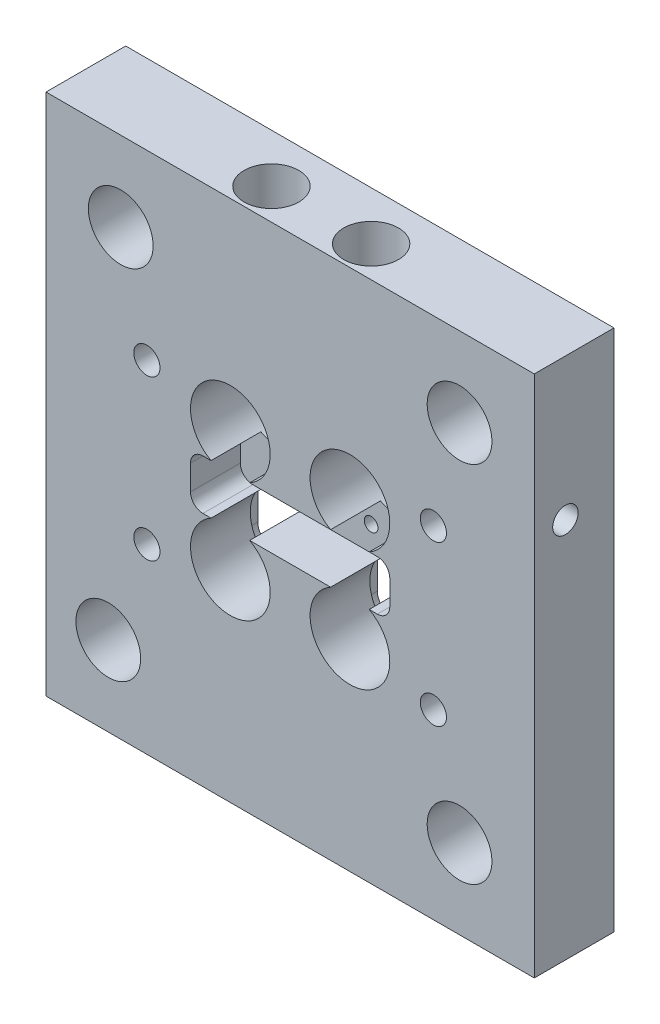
SolidWorks part; units mm, degrees
ref_plane "Plan de face" through (0, 0, 0) normal (0, 0, 1) x (1, 0, 0)
ref_plane "Plan de dessus" through (0, 0, 0) normal (0, 1, 0) x (1, 0, 0)
ref_plane "Plan de droite" through (0, 0, 0) normal (1, 0, 0) x (0, 0, -1)
sketch "Esquisse1" plane through (0, 0, 0) normal (0, 0, 1) x (1, 0, 0)
  line L1 (0, 0) -> (196, 0)
  line L2 (0, 0) -> (0, 210)
  line L3 (0, 210) -> (196, 210)
  line L4 (196, 0) -> (196, 210)
  dimension "D1" = 210
  dimension "D2" = 196
extrude "Extrusion1" add sketch "Esquisse1" along normal blind 32
sketch "Esquisse3" plane through (0, 0, 0) normal (0, 0, -1) x (-1, 0, 0)
  line L0 (-98, 210) -> (-98, 0) construction
  line L1 (-196, 210) -> (0, 210) construction
  line L2 (0, 0) -> (-196, 0) construction
  line L3 (-196, 105) -> (0, 105) construction
  line L4 (-196, 0) -> (-196, 210) construction
  line L5 (0, 210) -> (0, 0) construction
  line L6 (-214.75, 178) -> (45.0645, 178) construction
  line L7 (-218.7232, 32) -> (22.112, 32) construction
  line L8 (-166, 220.8332) -> (-166, -13.5838) construction
  line L9 (-25, 217.4713) -> (-25, -13.5838) construction
  line L10 (-30, 197.6571) -> (-30, 137.5989) construction
  circle A0 centre (-30, 178) radius 13
  circle A1 centre (-25, 32) radius 13
  circle A2 centre (-166, 32) radius 13
  circle A3 centre (-166, 178) radius 13
  dimension "D6" = 68
  dimension "D7" = 26
  dimension "D9" = 26
  dimension "D5" = 26
  dimension "D8" = 26
  dimension "D1" = 73
  dimension "D2" = 73
  dimension "D3" = 68
  dimension "D4" = 73
extrude "Enlèv. mat.-Extru.1" cut sketch "Esquisse3" against normal through all
sketch "Esquisse12" plane through (0, 0, 32) normal (0, 0, 1) x (1, 0, 0)
  line L0 (98, 210) -> (98, 0) construction
  line L1 (63, 115) -> (133, 115)
  line L2 (58, 110) -> (58, 100)
  line L3 (63, 95) -> (133, 95)
  line L4 (138, 110) -> (138, 100)
  line L5 (196, 210) -> (0, 210) construction
  line L6 (0, 0) -> (196, 0) construction
  line L7 (0, 105) -> (196, 105) construction
  line L8 (0, 210) -> (0, 0) construction
  line L9 (196, 0) -> (196, 210) construction
  arc A0 (63, 115) -> (58, 110) centre (63, 110) ccw
  arc A1 (133, 115) -> (138, 110) centre (133, 110) cw
  arc A2 (133, 95) -> (138, 100) centre (133, 100) ccw
  arc A3 (58, 100) -> (63, 95) centre (63, 100) ccw
  point P18 (58, 115)
  point P21 (138, 115)
  point P24 (138, 95)
  dimension "D5" = 5
  dimension "D1" = 20
  dimension "D2" = 80
  dimension "D3" = 10
  dimension "D4" = 40
extrude "Enlèv. mat.-Extru.6" cut sketch "Esquisse12" against normal blind 20
sketch "Esquisse13" plane through (0, 0, 32) normal (0, 0, 1) x (1, 0, 0)
  line L0 (40.9078, 129) -> (163.1596, 129) construction
  line L1 (40.9078, 81) -> (163.1596, 81) construction
  line L2 (122, 152.1631) -> (122, 49.4592) construction
  line L3 (74, 144.406) -> (74, 55.9752) construction
  line L4 (98, 210) -> (98, 0) construction
  line L5 (196, 210) -> (0, 210) construction
  line L6 (0, 0) -> (196, 0) construction
  line L7 (0, 105) -> (196, 105) construction
  line L8 (0, 210) -> (0, 0) construction
  line L9 (196, 0) -> (196, 210) construction
  circle A0 centre (122, 129) radius 16
  circle A1 centre (74, 129) radius 16
  circle A2 centre (74, 81) radius 16
  circle A3 centre (122, 81) radius 16
  dimension "D5" = 32
  dimension "D6" = 32
  dimension "D7" = 32
  dimension "D8" = 32
  dimension "D1" = 24
  dimension "D2" = 24
  dimension "D3" = 24
  dimension "D4" = 24
extrude "Enlèv. mat.-Extru.7" cut sketch "Esquisse13" against normal through all
sketch "Esquisse14" plane through (0, 0, 0) normal (0, 0, -1) x (-1, 0, 0)
  line L0 (-196, 105) -> (0, 105) construction
  line L1 (-196, 0) -> (-196, 210) construction
  line L2 (0, 210) -> (0, 0) construction
  line L3 (-98, 210) -> (-98, 0) construction
  line L4 (-196, 210) -> (0, 210) construction
  line L5 (0, 0) -> (-196, 0) construction
  line L7 (-137, 145) -> (-107, 145)
  line L8 (-143, 139) -> (-143, 119)
  line L9 (-137, 113) -> (-107, 113)
  line L10 (-101, 139) -> (-101, 119)
  line L11 (-89, 145) -> (-59, 145)
  line L12 (-95, 139) -> (-95, 119)
  line L13 (-89, 113) -> (-59, 113)
  line L14 (-53, 139) -> (-53, 119)
  line L15 (-89, 97) -> (-59, 97)
  line L16 (-95, 91) -> (-95, 71)
  line L17 (-89, 65) -> (-59, 65)
  line L18 (-53, 91) -> (-53, 71)
  line L19 (-137, 97) -> (-107, 97)
  line L20 (-143, 91) -> (-143, 71)
  line L21 (-137, 65) -> (-107, 65)
  line L22 (-101, 91) -> (-101, 71)
  circle A0 centre (-122, 129) radius 16 construction
  circle A1 centre (-74, 129) radius 16 construction
  circle A2 centre (-74, 81) radius 16 construction
  circle A3 centre (-122, 81) radius 16 construction
  arc A8 (-59, 145) -> (-53, 139) centre (-59, 139) cw
  arc A9 (-89, 145) -> (-95, 139) centre (-89, 139) ccw
  arc A10 (-95, 119) -> (-89, 113) centre (-89, 119) ccw
  arc A11 (-59, 113) -> (-53, 119) centre (-59, 119) ccw
  arc A12 (-59, 97) -> (-53, 91) centre (-59, 91) cw
  arc A13 (-89, 97) -> (-95, 91) centre (-89, 91) ccw
  arc A14 (-95, 71) -> (-89, 65) centre (-89, 71) ccw
  arc A15 (-59, 65) -> (-53, 71) centre (-59, 71) ccw
  arc A16 (-107, 65) -> (-101, 71) centre (-107, 71) ccw
  arc A17 (-143, 71) -> (-137, 65) centre (-137, 71) ccw
  arc A18 (-143, 119) -> (-137, 113) centre (-137, 119) ccw
  arc A19 (-137, 145) -> (-143, 139) centre (-137, 139) ccw
  arc A20 (-107, 145) -> (-101, 139) centre (-107, 139) cw
  arc A21 (-107, 113) -> (-101, 119) centre (-107, 119) ccw
  arc A22 (-107, 97) -> (-101, 91) centre (-107, 91) cw
  arc A23 (-137, 97) -> (-143, 91) centre (-137, 91) ccw
  point P38 (-53, 145)
  point P41 (-95, 145)
  point P52 (-95, 65)
  point P55 (-53, 65)
  point P58 (-101, 65)
  point P61 (-143, 65)
  point P66 (-143, 145)
  point P69 (-101, 145)
  dimension "D1" = 42
  dimension "D2" = 42
  dimension "D3" = 42
  dimension "D4" = 42
  dimension "D5" = 21
  dimension "D6" = 21
  dimension "D7" = 21
  dimension "D8" = 21
  dimension "D9" = 6
extrude "Enlèv. mat.-Extru.8" cut sketch "Esquisse14" against normal blind 8
hole_wizard "Trou taraudé M8x1.251" positions "Esquisse16" profile "Esquisse15" tap size "M8x1.25" standard "ISO"
sketch "Esquisse16" plane through (0, 0, 0) normal (0, 0, -1) x (-1, 0, 0)
  line L0 (-196, 105) -> (0, 105) construction
  line L1 (-196, 0) -> (-196, 210) construction
  line L2 (0, 210) -> (0, 0) construction
  line L3 (-98, 210) -> (-98, 0) construction
  line L4 (-196, 210) -> (0, 210) construction
  line L5 (0, 0) -> (-196, 0) construction
  point P0 (-63, 175)
  point P1 (-133, 175)
  point P2 (-133, 35)
  point P3 (-63, 35)
  dimension "D1" = 35
  dimension "D2" = 35
  dimension "D3" = 70
  dimension "D4" = 70
  dimension "D5" = 35
  dimension "D6" = 35
  dimension "D7" = 70
  dimension "D8" = 70
sketch "Esquisse15" plane through (63, 175, 0) normal (1, 0, 0) x (0, 1, 0)
  line L0 (0, 0) -> (0, 21.7929)
  line L1 (0, 21.7929) -> (3.4, 19.75)
  line L2 (3.4, 19.75) -> (3.4, 0)
  line L5 (3.4, 0) -> (0, 0)
  line L10 (0, 21.7929) -> (-3.4, 19.75) construction
  line L11 (0, -6.35) -> (0, 107.95) construction
  dimension "Diamètre du trou pour taraudage" = 6.8
  dimension "Profondeur du trou pour taraudage" = 19.75
  dimension "Angle de pointe" = 118
sketch "Esquisse17" plane through (0, 0, 0) normal (0, 0, -1) x (-1, 0, 0)
  line L0 (-197.2908, 105) -> (0, 105) construction
  line L1 (0, 210) -> (0, 0) construction
  line L2 (-98, 210) -> (-98, 0) construction
  line L3 (-196, 210) -> (0, 210) construction
  line L4 (0, 0) -> (-196, 0) construction
  circle A0 centre (-40.5, 137) radius 5.25
  circle A1 centre (-40.5, 73) radius 5.25
  circle A2 centre (-155.5, 73) radius 5.25
  circle A3 centre (-155.5, 137) radius 5.25
  circle A4 centre (-98, 105) radius 2.75
  dimension "D1" = 10.5
  dimension "D2" = 10.5
  dimension "D3" = 10.5
  dimension "D4" = 10.5
  dimension "D5" = 32
  dimension "D6" = 32
  dimension "D7" = 32
  dimension "D9" = 57.5
  dimension "D10" = 57.5
  dimension "D11" = 57.5
  dimension "D13" = 5.5
  dimension "D8" = 32
  dimension "D12" = 57.5
extrude "Enlèv. mat.-Extru.9" cut sketch "Esquisse17" against normal through all
hole_wizard "Chambrage pour vis à tête ronde bombée M51" positions "Esquisse19" profile "Esquisse18" counterbore size "M5" standard "ISO"
sketch "Esquisse19" plane through (0, 0, 0) normal (0, 0, -1) x (-1, 0, 0)
  line L0 (-196, 105) -> (0, 105) construction
  line L1 (-196, 0) -> (-196, 210) construction
  line L2 (0, 210) -> (0, 0) construction
  circle A0 centre (-98, 105) radius 2.75 construction
  point P1 (-110.5, 105)
  point P2 (-85.5, 105)
  dimension "D2" = 12.5
  dimension "D1" = 12.5
sketch "Esquisse18" plane through (110.5, 105, 0) normal (1, 0, 0) x (0, 1, 0)
  line L0 (0, 0) -> (0, 32)
  line L1 (0, 32) -> (2.75, 32)
  line L3 (2.75, 32) -> (2.75, 7)
  line L4 (2.75, 7) -> (5.5, 7)
  line L5 (5.5, 7) -> (5.5, 0)
  line L7 (5.5, 0) -> (0, 0)
  line L11 (0, -6.35) -> (0, 107.95) construction
  dimension "Diamètre du perçage jusqu'au prochain" = 5.5
  dimension "Profondeur du perçage jusqu'au prochain" = 32
  dimension "Diamètre du chambrage" = 11
  dimension "Profondeur du chambrage" = 7
sketch "Esquisse20" plane through (0, 210, 0) normal (0, 1, 0) x (-1, 0, 0)
  line L0 (-196, 32) -> (0, 32) construction
  line L1 (-98, 2.3769) -> (-98, 78.9265) construction
  line L2 (-196, 32) -> (-196, 0) construction
  circle A0 centre (-78, 19.5) radius 11
  circle A1 centre (-118, 19.5) radius 11
  dimension "D1" = 22
  dimension "D2" = 22
  dimension "D3" = 12.5
  dimension "D4" = 12.5
  dimension "D5" = 98
  dimension "D6" = 20
  dimension "D7" = 20
extrude "Enlèv. mat.-Extru.10" cut sketch "Esquisse20" against normal blind 18
hole_wizard "Diamètre du perçage M8.0 (8.000000)1" positions "Esquisse22" profile "Esquisse21" hole size "M8.0" standard "ISO"
sketch "Esquisse22" plane through (0, 210, 0) normal (0, 1, 0) x (-1, 0, 0)
  circle A0 centre (-78, 19.5) radius 11 construction
  circle A1 centre (-118, 19.5) radius 11 construction
  point P1 (-78, 19.5)
  point P2 (-118, 19.5)
sketch "Esquisse21" plane through (78, 210, 19.5) normal (1, 0, 0) x (0, 0, 1)
  line L0 (0, 0) -> (0, 61)
  line L1 (0, 61) -> (4, 57)
  line L2 (4, 57) -> (4, 0)
  line L5 (4, 0) -> (0, 0)
  line L10 (0, 61) -> (-4, 57) construction
  line L11 (0, -6.35) -> (0, 107.95) construction
  dimension "Diamètre du perçage" = 8
  dimension "Profondeur du perçage" = 57
  dimension "Angle de pointe" = 90
hole_wizard "Diamètre du perçage M8.0 (8.000000)2" positions "Esquisse24" profile "Esquisse23" hole size "M8.0" standard "ISO"
sketch "Esquisse24" plane through (0, 0, 0) normal (0, -1, 0) x (1, 0, 0)
  line L0 (0, 32) -> (196, 32) construction
  line L2 (98, 66.8544) -> (98, 0) construction
  line L4 (0, 0) -> (196, 0) construction
  point P0 (52, 19.5)
  point P1 (144, 19.5)
  dimension "D1" = 12.5
  dimension "D2" = 12.5
  dimension "D3" = 46
  dimension "D4" = 46
sketch "Esquisse23" plane through (52, 0, 19.5) normal (1, 0, 0) x (0, 0, -1)
  line L0 (0, 0) -> (0, 155.4034)
  line L1 (0, 155.4034) -> (4, 153)
  line L2 (4, 153) -> (4, 0)
  line L5 (4, 0) -> (0, 0)
  line L10 (0, 155.4034) -> (-4, 153) construction
  line L11 (0, -6.35) -> (0, 107.95) construction
  dimension "Diamètre du perçage" = 8
  dimension "Profondeur du perçage" = 153
  dimension "Angle de pointe" = 118
hole_wizard "Diamètre du perçage M8.0 (8.000000)3" positions "Esquisse26" profile "Esquisse25" hole size "M8.0" standard "ISO"
sketch "Esquisse26" plane through (0, 0, 0) normal (-1, 0, 0) x (0, 0, 1)
  line L0 (32, 210) -> (32, 0) construction
  line L2 (0, 105) -> (112.1415, 105) construction
  line L3 (0, 210) -> (0, 0) construction
  point P0 (19.5, 57)
  dimension "D1" = 12.5
  dimension "D2" = 48
sketch "Esquisse25" plane through (0, 57, 19.5) normal (0, 1, 0) x (0, 0, 1)
  line L0 (0, 0) -> (0, 148)
  line L1 (0, 148) -> (4, 144)
  line L2 (4, 144) -> (4, 0)
  line L5 (4, 0) -> (0, 0)
  line L10 (0, 148) -> (-4, 144) construction
  line L11 (0, -6.35) -> (0, 107.95) construction
  dimension "Diamètre du perçage" = 8
  dimension "Profondeur du perçage" = 144
  dimension "Angle de pointe" = 90
hole_wizard "Diamètre du perçage M8.0 (8.000000)4" positions "Esquisse28" profile "Esquisse27" hole size "M8.0" standard "ISO"
sketch "Esquisse28" plane through (0, 0, 0) normal (-1, 0, 0) x (0, 0, 1)
  line L0 (32, 210) -> (32, 0) construction
  line L1 (0, 105) -> (75.319, 105) construction
  line L2 (0, 210) -> (0, 0) construction
  point P0 (19.5, 153)
  dimension "D1" = 12.5
  dimension "D2" = 48
sketch "Esquisse27" plane through (0, 153, 19.5) normal (0, 1, 0) x (0, 0, 1)
  line L0 (0, 0) -> (0, 86)
  line L1 (0, 86) -> (4, 82)
  line L2 (4, 82) -> (4, 0)
  line L5 (4, 0) -> (0, 0)
  line L10 (0, 86) -> (-4, 82) construction
  line L11 (0, -6.35) -> (0, 107.95) construction
  dimension "Diamètre du perçage" = 8
  dimension "Profondeur du perçage" = 82
  dimension "Angle de pointe" = 90
hole_wizard "Diamètre du perçage M8.0 (8.000000)5" positions "Esquisse30" profile "Esquisse29" hole size "M8.0" standard "ISO"
sketch "Esquisse30" plane through (196, 0, 0) normal (1, 0, 0) x (0, 0, -1)
  line L0 (-32, 0) -> (-32, 210) construction
  line L1 (0, 105) -> (-114.8835, 105) construction
  line L2 (0, 0) -> (0, 210) construction
  point P0 (-19.5, 153)
  dimension "D1" = 12.5
  dimension "D2" = 48
sketch "Esquisse29" plane through (196, 153, 19.5) normal (0, 1, 0) x (0, 0, -1)
  line L0 (0, 0) -> (0, 86)
  line L1 (0, 86) -> (4, 82)
  line L2 (4, 82) -> (4, 0)
  line L5 (4, 0) -> (0, 0)
  line L10 (0, 86) -> (-4, 82) construction
  line L11 (0, -6.35) -> (0, 107.95) construction
  dimension "Diamètre du perçage" = 8
  dimension "Profondeur du perçage" = 82
  dimension "Angle de pointe" = 90
hole_wizard "Trou taraudé M12x1.751" positions "Esquisse33" profile "Esquisse32" tap size "M12x1.75" standard "ISO"
sketch "Esquisse33" plane through (196, 0, 0) normal (1, 0, 0) x (0, 0, -1)
  circle A0 centre (-19.5, 153) radius 4 construction
  point P0 (-19.5, 153)
sketch "Esquisse32" plane through (196, 153, 19.5) normal (0, 1, 0) x (0, 0, -1)
  line L0 (0, 0) -> (0, 10)
  line L1 (0, 10) -> (5.1, 10)
  line L2 (5.1, 10) -> (5.1, 0)
  line L5 (5.1, 0) -> (0, 0)
  line L10 (0, 10) -> (-5.1, 10) construction
  line L11 (0, -6.35) -> (0, 107.95) construction
  dimension "Diamètre du trou pour taraudage" = 10.2
  dimension "Profondeur du trou pour taraudage" = 10
  dimension "Angle de pointe" = 180
hole_wizard "Trou taraudé M12x1.752" positions "Esquisse35" profile "Esquisse34" tap size "M12x1.75" standard "ISO"
sketch "Esquisse35" plane through (0, 0, 0) normal (-1, 0, 0) x (0, 0, 1)
  circle A0 centre (19.5, 153) radius 4 construction
  circle A1 centre (19.5, 57) radius 4 construction
  point P0 (19.5, 57)
  point P1 (19.5, 153)
sketch "Esquisse34" plane through (0, 57, 19.5) normal (0, 1, 0) x (0, 0, 1)
  line L0 (0, 0) -> (0, 10)
  line L1 (0, 10) -> (5.1, 10)
  line L2 (5.1, 10) -> (5.1, 0)
  line L5 (5.1, 0) -> (0, 0)
  line L10 (0, 10) -> (-5.1, 10) construction
  line L11 (0, -6.35) -> (0, 107.95) construction
  dimension "Diamètre du trou pour taraudage" = 10.2
  dimension "Profondeur du trou pour taraudage" = 10
  dimension "Angle de pointe" = 180
hole_wizard "Trou taraudé M12x1.753" positions "Esquisse3D2" profile "Esquisse36" tap size "M12x1.75" standard "ISO"
sketch3d "Esquisse3D2"
  circle A2 centre (52, 0, 19.5) radius 4 construction
  circle A3 centre (144, 0, 19.5) radius 4 construction
  point P0 (52, 0, 19.5)
  point P1 (144, 0, 19.5)
  point P4 (52, -4, 19.5)
  point P7 (144, -4, 19.5)
sketch "Esquisse36" plane through (52, 0, 19.5) normal (1, 0, 0) x (0, 0, -1)
  line L0 (0, 0) -> (0, 10)
  line L1 (0, 10) -> (5.1, 10)
  line L2 (5.1, 10) -> (5.1, 0)
  line L5 (5.1, 0) -> (0, 0)
  line L10 (0, 10) -> (-5.1, 10) construction
  line L11 (0, -6.35) -> (0, 107.95) construction
  dimension "Diamètre du trou pour taraudage" = 10.2
  dimension "Profondeur du trou pour taraudage" = 10
  dimension "Angle de pointe" = 180
hole_wizard "Trou taraudé M10x1.51" positions "Esquisse38" profile "Esquisse37" tap size "M10x1.5" standard "ISO"
sketch "Esquisse38" plane through (0, 192, 0) normal (0, 1, 0) x (-1, 0, 0)
  circle A1 centre (-118, 19.5) radius 4 construction
  circle A2 centre (-78, 19.5) radius 4 construction
  point P0 (-78, 19.5)
  point P1 (-118, 19.5)
sketch "Esquisse37" plane through (78, 192, 19.5) normal (1, 0, 0) x (0, 0, 1)
  line L0 (0, 0) -> (0, 12)
  line L1 (0, 12) -> (4.25, 12)
  line L2 (4.25, 12) -> (4.25, 0)
  line L5 (4.25, 0) -> (0, 0)
  line L10 (0, 12) -> (-4.25, 12) construction
  line L11 (0, -6.35) -> (0, 107.95) construction
  dimension "Diamètre du trou pour taraudage" = 8.5
  dimension "Profondeur du trou pour taraudage" = 12
  dimension "Angle de pointe" = 180
sketch "Esquisse39" plane through (0, 0, 0) normal (0, 0, -1) x (-1, 0, 0)
  circle A0 centre (-30, 178) radius 17
  circle A1 centre (-25, 32) radius 17
  circle A2 centre (-166, 32) radius 17
  circle A3 centre (-166, 178) radius 17
  circle A4 centre (-166, 178) radius 13 construction
  circle A5 centre (-30, 178) radius 13 construction
  circle A6 centre (-166, 32) radius 13 construction
  circle A7 centre (-25, 32) radius 13 construction
  dimension "D1" = 34
  dimension "D2" = 34
  dimension "D3" = 34
  dimension "D4" = 34
extrude "Enlèv. mat.-Extru.11" cut sketch "Esquisse39" against normal blind 6.3
